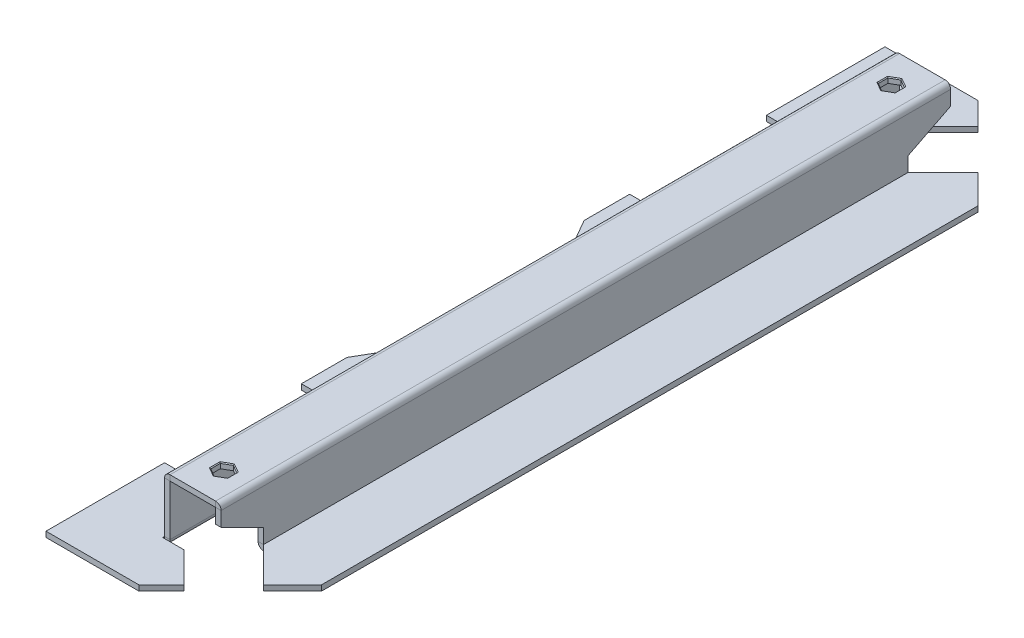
SolidWorks part; units mm, degrees
other "<Raidisseur>-<Plier1>"
ref_plane "Plan de face" through (0, 0, 0) normal (0, 0, 1) x (1, 0, 0)
ref_plane "Plan de dessus" through (0, 0, 0) normal (0, 1, 0) x (1, 0, 0)
ref_plane "Plan de droite" through (0, 0, 0) normal (1, 0, 0) x (0, 0, -1)
mirrored part "Raidisseur_Symétrique"
